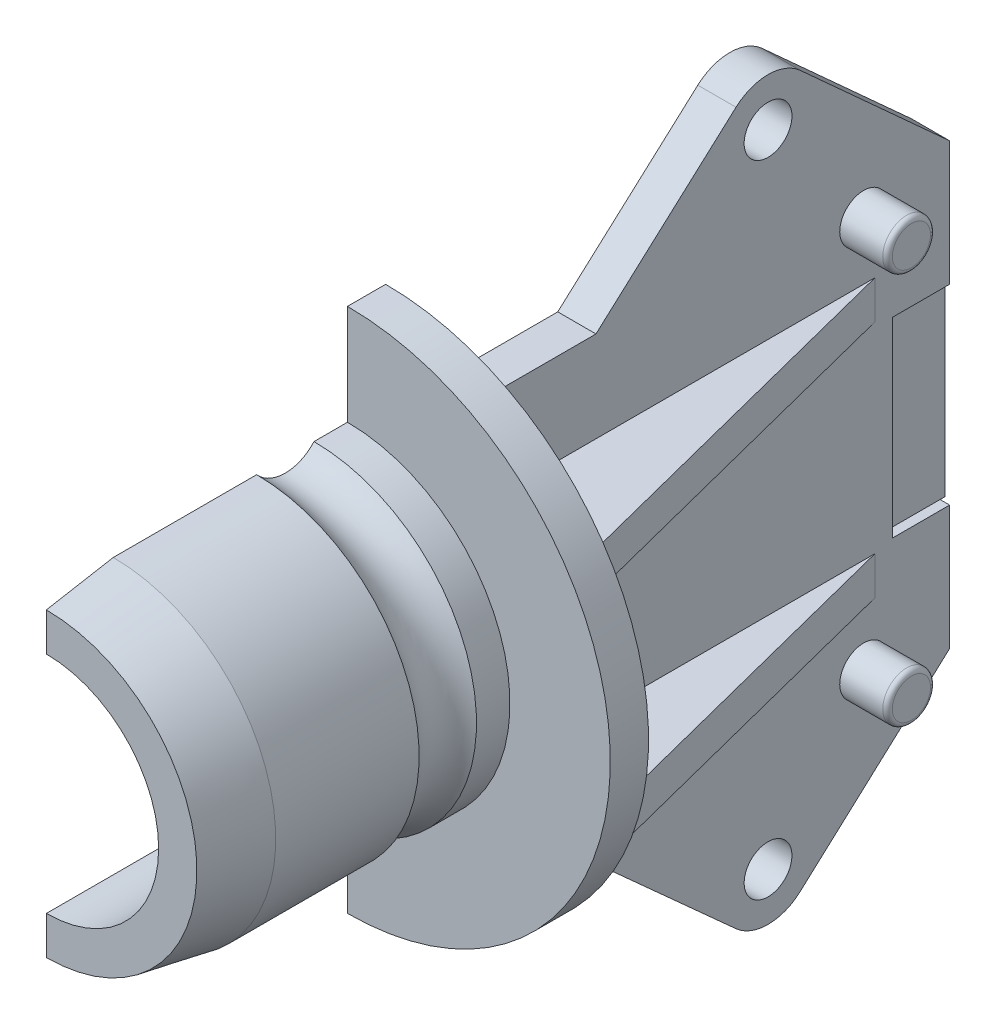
SolidWorks part; units mm, degrees
ref_plane "Plan1" through (0, 0, 0) normal (0, 0, 1) x (1, 0, 0)
ref_plane "Plan2" through (0, 0, 0) normal (0, 1, 0) x (1, 0, 0)
ref_plane "Plan3" through (0, 0, 0) normal (1, 0, 0) x (0, 0, -1)
sketch "Esquisse2" plane through (0, 0, 0) normal (1, 0, 0) x (0, 0, -1)
  line L0 (-54, 0) -> (127, 0) construction
  line L1 (0, 23.5) -> (46, 23.5)
  line L2 (46, 23.5) -> (46, 22)
  line L3 (46, 22) -> (63, 22)
  line L4 (63, 22) -> (63, 15)
  line L5 (63, 15) -> (71, 15)
  line L6 (71, 15) -> (71, 55)
  line L7 (71, 55) -> (63, 55)
  line L8 (63, 55) -> (63, 34)
  line L9 (63, 34) -> (56, 34)
  line L10 (44, 34) -> (14, 34)
  line L11 (14, 34) -> (0, 31.5)
  line L12 (0, 31.5) -> (0, 23.5)
  arc A0 (56, 34) -> (44, 34) centre (50, 39.2915) cw
  dimension "D8" = 8
  dimension "D1" = 46
  dimension "D2" = 17
  dimension "D3" = 8
  dimension "D4" = 8
  dimension "D5" = 10.5
  dimension "D6" = 14
  dimension "D7" = 30
  dimension "D9" = 7
  dimension "D10" = 40
  dimension "D11" = 23.5
  dimension "D12" = 22
  dimension "D13" = 15
revolve "Nez" add sketch "Esquisse2" angle 360 about L0
ref_plane "Plan4" through (16, 0, 0) normal (1, 0, 0) x (0, 0, -1)
sketch "Esquisse3" plane through (16, 0, 0) normal (1, 0, 0) x (0, 0, -1)
  line L0 (71, 48) -> (91, 48)
  line L1 (71, -55) -> (71, 55) construction
  line L2 (91, 48) -> (120.3028, 74.4262)
  line L3 (133.7227, 74.403) -> (165, 46)
  line L4 (165, 46) -> (165, 0)
  line L5 (68, 0) -> (169, 0) construction
  line L6 (-54, 0) -> (127, 0) construction
  line L7 (165, -46) -> (165, 0)
  line L8 (133.7227, -74.403) -> (165, -46)
  line L9 (91, -48) -> (120.3028, -74.4262)
  line L10 (71, -48) -> (91, -48)
  line L11 (71, 48) -> (71, -48)
  arc A0 (120.3028, 74.4262) -> (133.7227, 74.403) centre (127, 67) cw
  arc A1 (120.3028, -74.4262) -> (133.7227, -74.403) centre (127, -67) ccw
  circle A2 centre (127, 67) radius 5
  circle A3 centre (127, -67) radius 5
  circle A4 centre (147, -41) radius 5
  dimension "D3" = 10
  dimension "D8" = 10
  dimension "D9" = 20
  dimension "D10" = 26
  dimension "D1" = 96
  dimension "D2" = 20
  dimension "D4" = 36
  dimension "D5" = 94
  dimension "D6" = 67
  dimension "D7" = 46
extrude "Aile" add sketch "Esquisse3" along normal blind 8
ref_plane "Plan5" through (0, 25, 0) normal (0, 1, 0) x (-1, 0, 0)
sketch "Esquisse4" plane through (0, 25, 0) normal (0, 1, 0) x (-1, 0, 0)
  line L0 (-44, -71) -> (-24, -149.3614)
  line L1 (-55, -71) -> (55, -71) construction
  line L2 (-24, -165) -> (-24, -133.7227) construction
  line L3 (-24, -91) -> (-24, -71) construction
  line L4 (-44, -71) -> (-24, -71)
  line L5 (-24, -71) -> (-24, -149.3614)
  line L6 (-24, -91) -> (-24, -71) construction
  dimension "D1" = 20
extrude "nervure" add sketch "Esquisse4" along normal mid plane 8
mirror "Symétrie2" about plane through (0, 0, 0) normal (0, 1, 0)
mirror "Symétrie1" about plane through (0, 0, 0) normal (1, 0, 0)
sketch "Esquisse7" plane through (0, 0, -165) normal (0, 0, -1) x (-1, 0, 0)
  line L0 (24, -46) -> (24, 46) construction
  line L1 (24, -20) -> (-24, -20)
  line L2 (24, -20) -> (24, 20)
  line L3 (24, 20) -> (-24, 20)
  line L4 (-24, -20) -> (-24, 20)
  line L5 (-24, -46) -> (-24, 46) construction
  line L6 (24, 0) -> (-24, 0) construction
  dimension "D1" = 40
extrude "Rainure" cut sketch "Esquisse7" against normal blind 12
sketch "Esquisse5" plane through (0, 0, -153) normal (0, 0, -1) x (-1, 0, 0)
  line L1 (-23, 19) -> (23, 19)
  line L2 (-23, 19) -> (-23, -19)
  line L3 (-23, -19) -> (23, -19)
  line L4 (23, 19) -> (23, -19)
  line L6 (-23, 0) -> (23, 0) construction
  line L7 (-24, 20) -> (-24, -20) construction
  circle A0 centre (0, 0) radius 5
  dimension "D2" = 10
  dimension "D1" = 38
  dimension "D3" = 1
extrude "Palier avant" add sketch "Esquisse5" along normal blind 12
sketch "Esquisse6" plane through (0, 0, 0) normal (0, 0, 1) x (1, 0, 0)
  line L0 (0, 93) -> (0, -90)
extrude "Coupe" cut sketch "Esquisse6" against normal through all and the other way through all flip side to cut
sketch "Esquisse8" plane through (16, 0, 0) normal (-1, 0, 0) x (0, 0, 1)
  circle A0 centre (-147, -41) radius 5 construction
  circle A1 centre (-147, -41) radius 5
extrude "Axe J" add sketch "Esquisse8" against normal blind 18
fillet "Congé1" radius 1
mirror "Symétrie3" about plane through (0, 0, 0) normal (0, 1, 0)
ref_plane "Plan6" through (29, 0, 0) normal (1, 0, 0) x (0, 0, -1)
sketch "Point J" plane through (29, 0, 0) normal (1, 0, 0) x (0, 0, -1)
  point P0 (147, -41)
sketch "Point J'" plane through (29, 0, 0) normal (1, 0, 0) x (0, 0, -1)
  point P0 (147, 41)
